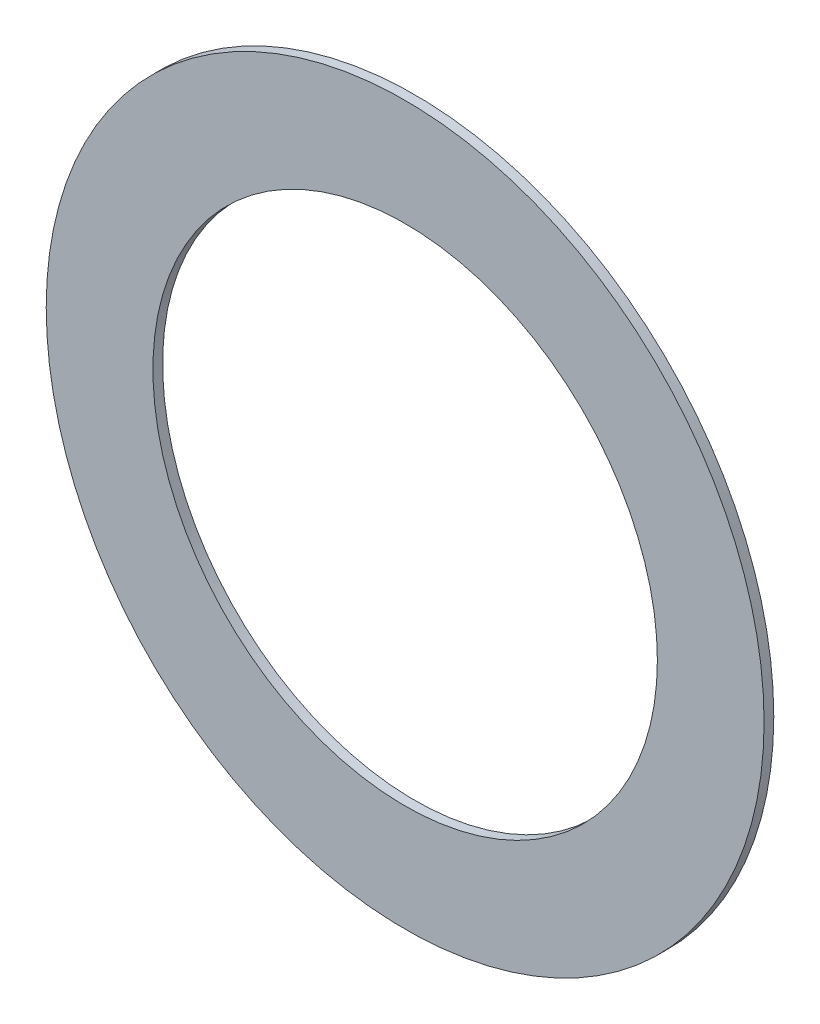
SolidWorks part; units mm, degrees
ref_plane "Plan1" through (0, 0, 0) normal (0, 0, 1) x (1, 0, 0)
ref_plane "Plan2" through (0, 0, 0) normal (0, 1, 0) x (1, 0, 0)
ref_plane "Plan3" through (0, 0, 0) normal (1, 0, 0) x (0, 0, -1)
sketch "Esquisse1" plane through (0, 0, 0) normal (1, 0, 0) x (0, 0, -1)
  line L0 (0.125, 6.5) -> (-0.125, 6.5)
  line L1 (0.125, 6.5) -> (0.125, 9.25)
  line L2 (-0.125, 9.25) -> (0.125, 9.25)
  line L3 (-0.125, 9.25) -> (-0.125, 6.5)
  line L4 (0, 0) -> (8, 0) construction
  dimension "D1" = 0.25
  dimension "D2" = 6.5
  dimension "D3" = 9.25
  dimension "D4" = 0.125
revolve "Base-Révolution" add sketch "Esquisse1" angle 360 about L4
